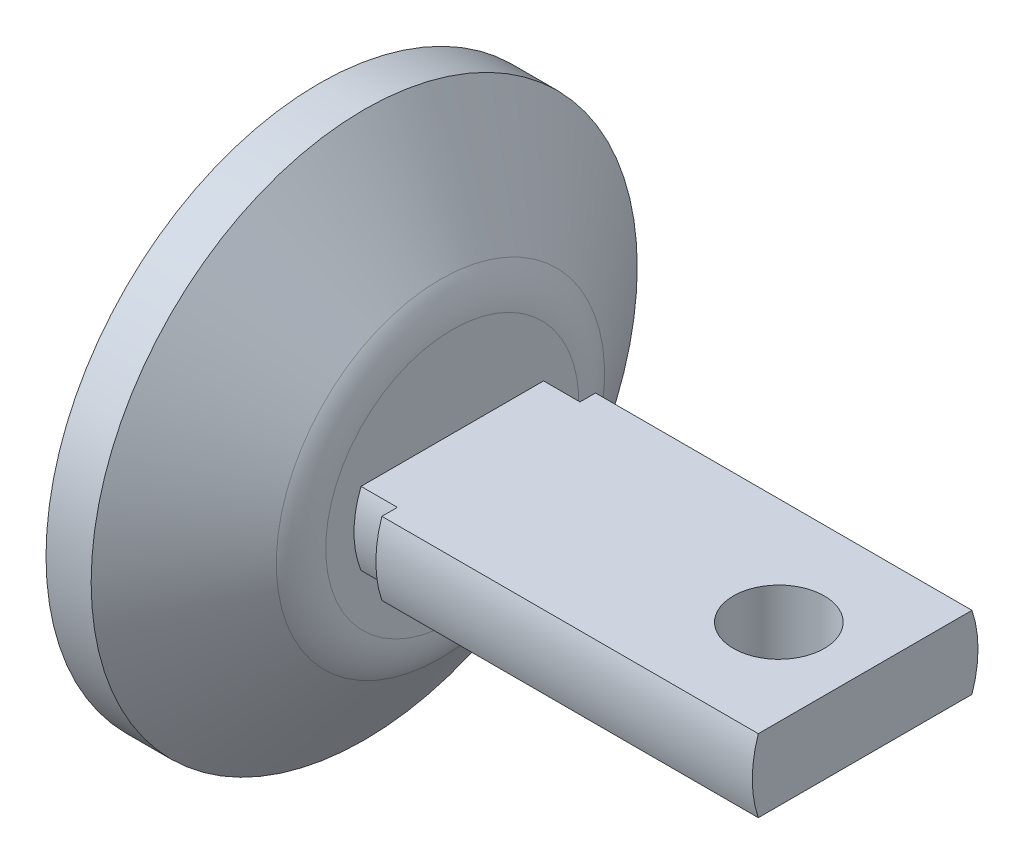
SolidWorks part; units mm, degrees
ref_plane "Front Plane" through (0, 0, 0) normal (0, 0, 1) x (1, 0, 0)
ref_plane "Top Plane" through (0, 0, 0) normal (0, 1, 0) x (1, 0, 0)
ref_plane "Right Plane" through (0, 0, 0) normal (1, 0, 0) x (0, 0, -1)
sketch "Sketch1" plane through (0, 0, 0) normal (0, 0, 1) x (1, 0, 0)
  line L0 (6.858, 0) -> (31.5809, 0) construction
  line L3 (6.858, 0) -> (6.858, 9.525)
  line L4 (6.858, 9.525) -> (8.4328, 9.525)
  line L5 (6.858, 0) -> (25.908, 0)
  line L6 (25.908, 0) -> (25.908, 3.937)
  line L7 (25.908, 3.937) -> (12.7762, 3.937)
  line L8 (8.4328, 9.525) -> (11.0928, 5.7262)
  line L9 (11.5062, 4.415) -> (11.5062, 3.429)
  line L10 (11.5062, 3.429) -> (12.7762, 3.429)
  line L11 (12.7762, 3.429) -> (12.7762, 3.937)
  arc A0 (11.0928, 5.7262) -> (11.5062, 4.415) centre (9.2202, 4.415) cw
  dimension "D10" = 2.286
  dimension "D2" = 7.874
  dimension "D4" = 19.05
  dimension "D5" = 14.4018
  dimension "D6" = 1.27
  dimension "D7" = 6.858
  dimension "D8" = 1.5748
  dimension "D9" = 35
  dimension "D11" = 4.6482
revolve "Revolve1" add sketch "Sketch1" angle 360 about L0
sketch "Sketch2" plane through (25.908, 0, 0) normal (1, 0, 0) x (0, 0, -1)
  line L0 (0, 0) -> (0, 3.253) construction
  line L1 (4.064, 0) -> (-4.064, 0) construction
  line L2 (3.8605, 1.27) -> (-3.8605, 1.27)
  line L3 (3.8605, -1.27) -> (-3.8605, -1.27)
  line L4 (4.064, -1.27) -> (-4.064, -1.27) construction
  line L5 (4.064, 1.27) -> (-4.064, 1.27) construction
  arc A0 (-3.8605, 1.27) -> (-3.8605, -1.27) centre (0, 0) ccw
  arc A1 (3.8605, -1.27) -> (3.8605, 1.27) centre (0, 0) ccw
  circle A2 centre (0, 0) radius 5.08
  dimension "D2" = 8.128
  dimension "D1" = 90
  dimension "D3" = 1.27
  dimension "D4" = 1.27
extrude "Cut-Extrude2" cut sketch "Sketch2" against normal up to surface (14.4018 mm away) contours A2 A1 L3 A0 L2 M7 | L3 M7 | L2 M7
sketch "Sketch4" plane through (0, 1.27, 0) normal (0, 1, 0) x (1, 0, 0)
  line L0 (6.858, 0) -> (22.8981, 0) construction
  line L2 (6.858, 9.525) -> (6.858, -9.525) construction
  line L3 (11.5062, 3.1851) -> (11.5062, -3.1851) construction
  circle A0 centre (22.8981, 0) radius 1.5875
  dimension "D1" = 3.175
  dimension "D2" = 11.3919
extrude "Cut-Extrude3" cut sketch "Sketch4" against normal up to next
sketch "Sketch5" plane through (6.858, 0, 0) normal (-1, 0, 0) x (0, 0, 1)
  line L0 (0, 0) -> (0, 9.525) construction
  line L1 (0, 0) -> (-9.4888, -0.8302) construction
  line L2 (-6.1277, -2.8181) -> (-6.3258, -0.5534) construction
  line L3 (-6.3258, -0.5534) -> (-6.3037, -0.8065) construction
  line L8 (-4.3142, -0.3774) -> (-4.2921, -0.6305)
  line L9 (-8.3375, -0.7294) -> (-8.3153, -0.9825)
  circle A0 centre (0, 0) radius 9.525 construction
  arc A5 (-4.3142, -0.3774) -> (-8.3375, -0.7294) centre (-6.3258, -0.5534) ccw
  arc A6 (-8.3153, -0.9825) -> (-4.2921, -0.6305) centre (-6.3037, -0.8065) ccw
  point P11 (-6.3148, -0.68)
  point P16 (0, 0)
  point P17 (0, 0)
  point P18 (-6.1277, -2.8181)
  point P19 (-6.3258, -0.5534)
  dimension "D3" = 4.0386
  dimension "D5" = 2.0193
  dimension "D1" = 95
  dimension "D2" = 6.35
  dimension "D4" = 0.254
extrude "Boss-Extrude2" add sketch "Sketch5" along normal blind 6.858
sketch "Sketch7" plane through (6.858, 0, 0) normal (-1, 0, 0) x (0, 0, 1)
  line L0 (-6.5018, 1.4582) -> (-6.1498, -2.5651) construction
  line L1 (-6.1277, -2.8181) -> (-6.3258, -0.5534) construction
  circle A0 centre (-6.3258, -0.5534) radius 2.0193
  circle A1 centre (-6.3258, -0.5534) radius 2.4341
  point P9 (0, 0)
extrude "Cut-Extrude5" cut sketch "Sketch7" along normal blind 3.5052
